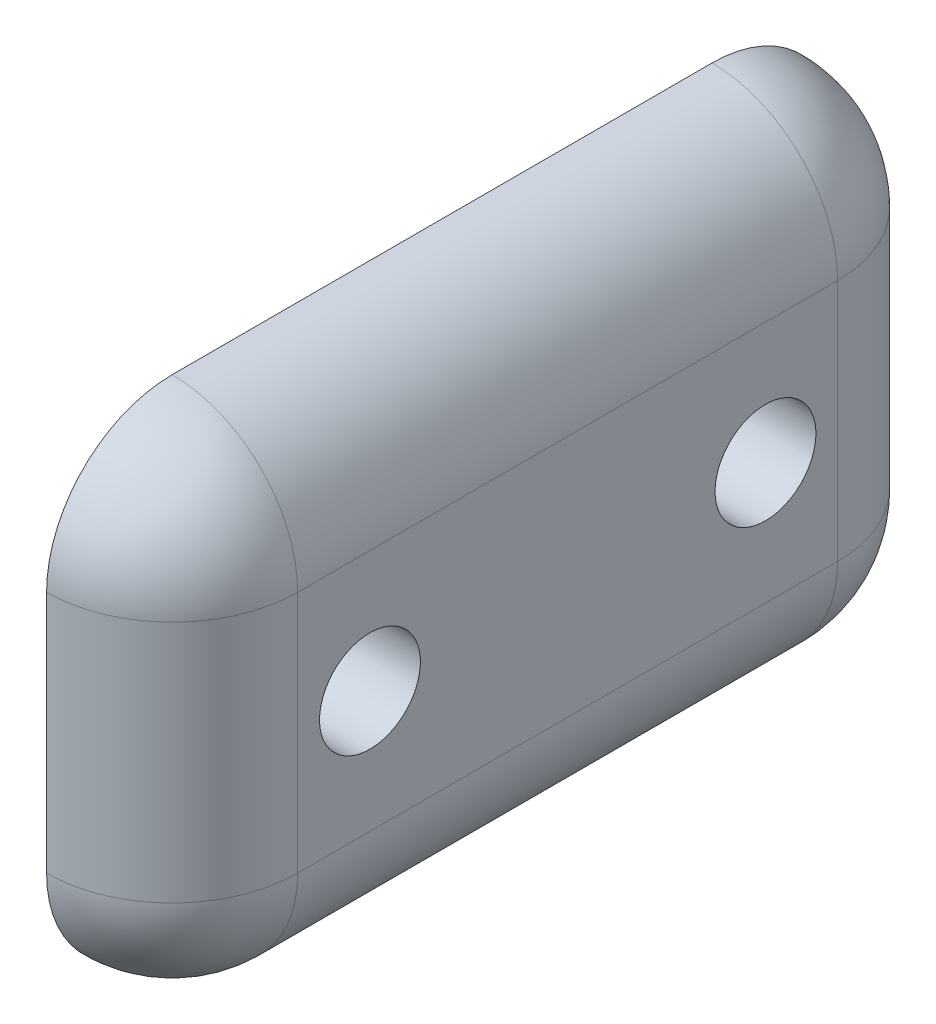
SolidWorks part; units mm, degrees
ref_plane "Front Plane" through (0, 0, 0) normal (0, 0, 1) x (1, 0, 0)
ref_plane "Top Plane" through (0, 0, 0) normal (0, 1, 0) x (1, 0, 0)
ref_plane "Right Plane" through (0, 0, 0) normal (1, 0, 0) x (0, 0, -1)
sketch "Sketch1" plane through (0, 0, 0) normal (1, 0, 0) x (0, 0, -1)
  line L1 (-20, 12.5) -> (20, 12.5)
  line L2 (-20, 12.5) -> (-20, -12.5)
  line L3 (-20, -12.5) -> (20, -12.5)
  line L4 (20, 12.5) -> (20, -12.5)
  point P4 (0, 12.5)
  point P5 (-20, 0)
  dimension "D1" = 40
  dimension "D2" = 25
extrude "Extrude1" add sketch "Sketch1" along normal mid plane 6.35
fillet "Fillet1" radius 6.35 4 edges at (3.175, 12.5, 0) (3.175, 0, -20) (3.175, -12.5, 0) (3.175, 0, 20)
hole_wizard "M5.1 (5.1) Diameter Hole1" positions "Sketch3" profile "Sketch2" hole size "M5.1" standard "Ansi Metric"
sketch "Sketch3" plane through (-3.175, 0, 0) normal (-1, 0, 0) x (0, 0, 1)
  line L0 (-10, 0) -> (10, 0) construction
  point P0 (10, 0)
  point P1 (-10, 0)
  dimension "D1" = 20
sketch "Sketch2" plane through (-3.175, 0, 10) normal (0, 1, 0) x (0, 0, 1)
  line L0 (0, 0) -> (0, 6.35)
  line L1 (0, 6.35) -> (2.55, 6.35)
  line L2 (2.55, 6.35) -> (2.55, 0)
  line L5 (2.55, 0) -> (0, 0)
  line L11 (0, -6.35) -> (0, 107.95) construction
  dimension "Thru Hole Dia." = 5.1
  dimension "Thru Hole Depth" = 6.35
